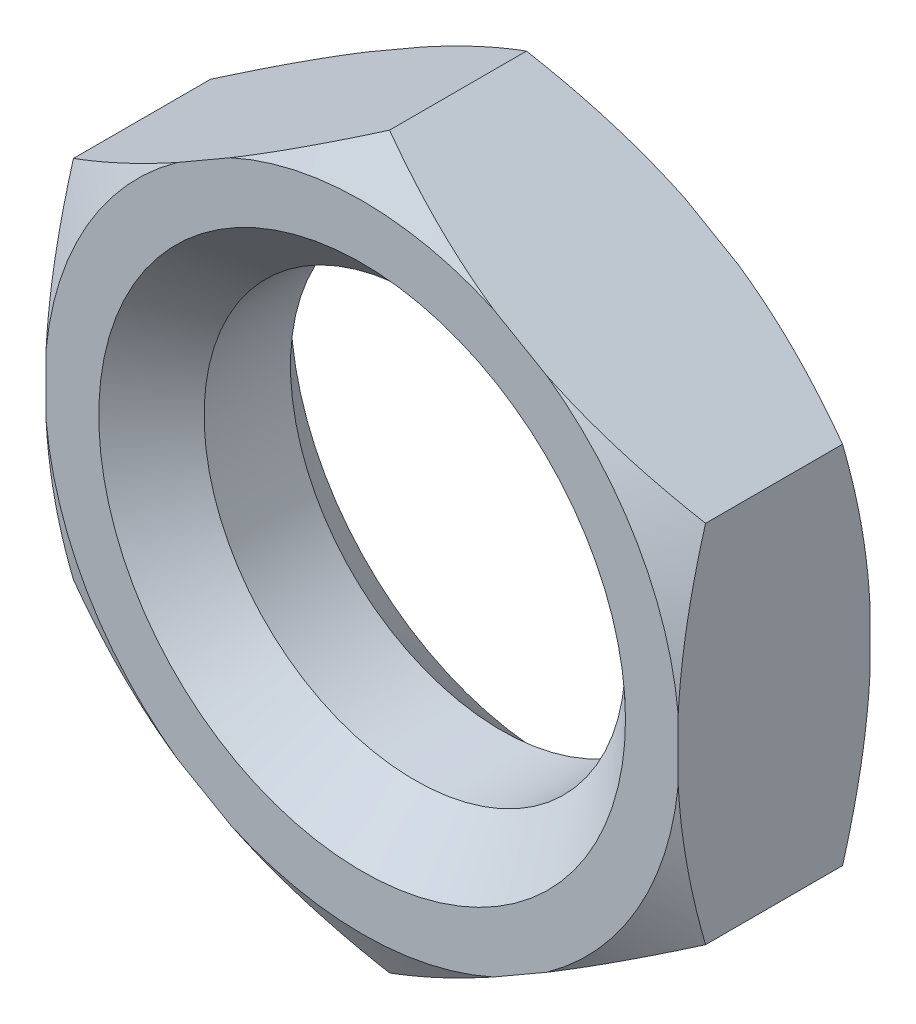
SolidWorks part; units mm, degrees
ref_plane "Front Plane" through (0, 0, 0) normal (0, 0, 1) x (1, 0, 0)
ref_plane "Top Plane" through (0, 0, 0) normal (0, 1, 0) x (1, 0, 0)
ref_plane "Right Plane" through (0, 0, 0) normal (1, 0, 0) x (0, 0, -1)
sketch "Sketch3" plane through (0, 0, 0) normal (0, 0, 1) x (1, 0, 0)
  line L1 (0, 17.3205) -> (-15, 8.6603)
  line L2 (-15, 8.6603) -> (-15, -8.6603)
  line L3 (-15, -8.6603) -> (0, -17.3205)
  line L4 (0, -17.3205) -> (15, -8.6603)
  line L5 (15, -8.6603) -> (15, 8.6603)
  line L6 (15, 8.6603) -> (0, 17.3205)
  circle A0 centre (0, 0) radius 15 construction
  dimension "D1" = 30
extrude "Boss-Extrude1" add sketch "Sketch3" along normal mid plane 9.1
sketch "Sketch4" plane through (0, 0, 0) normal (1, 0, 0) x (0, 0, -1)
  line L0 (-5.4578, 0) -> (6.1545, 0) construction
sketch "Sketch5" plane through (0, 0, 0) normal (1, 0, 0) x (0, 0, -1)
  line L0 (-4.55, 17.3205) -> (-4.55, 15.0705)
  line L1 (-4.55, 8.6603) -> (-4.55, 17.3205) construction
  line L2 (-4.55, 15.0705) -> (-3.251, 17.3205)
  line L3 (-4.55, 17.3205) -> (4.55, 17.3205) construction
  line L4 (-3.251, 17.3205) -> (-4.55, 17.3205)
  dimension "D1" = 2.25
  dimension "D2" = 30
revolve "Cut-Revolve1" cut sketch "Sketch5" angle 360 about L0
mirror "Mirror1" about plane through (0, 0, 0) normal (0, 0, 1) of "Cut-Revolve1"
sketch "Sketch6" plane through (0, 0, 4.55) normal (0, 0, 1) x (1, 0, 0)
  circle A0 centre (0, 0) radius 10
  dimension "D1" = 20
extrude "Cut-Extrude1" cut sketch "Sketch6" against normal blind 9.1
chamfer "Chamfer1" distance 2.5 angle 45 2 edges at (10, 0, -4.55) (10, 0, 4.55)
